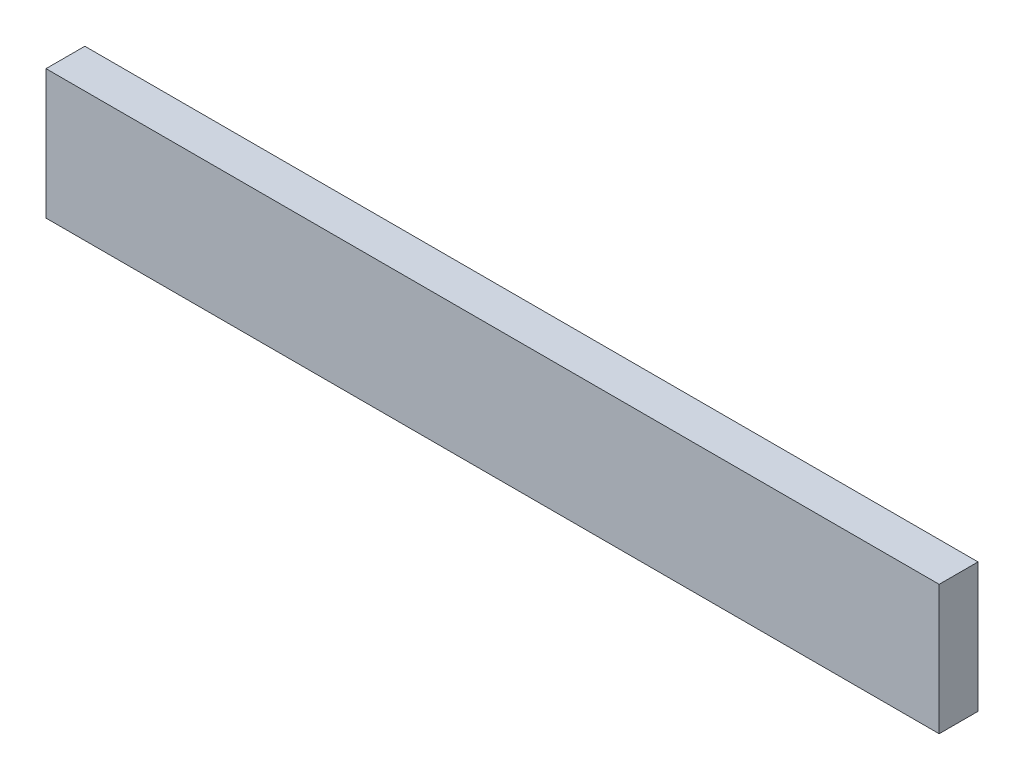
SolidWorks part; units mm, degrees
ref_plane "Plan de face" through (0, 0, 0) normal (0, 0, 1) x (1, 0, 0)
ref_plane "Plan de dessus" through (0, 0, 0) normal (0, 1, 0) x (1, 0, 0)
ref_plane "Plan de droite" through (0, 0, 0) normal (1, 0, 0) x (0, 0, -1)
sketch "Esquisse1" plane through (0, 0, 0) normal (0, 0, 1) x (1, 0, 0)
  line L1 (-207, -30) -> (207, -30)
  line L2 (-207, -30) -> (-207, 30)
  line L3 (-207, 30) -> (207, 30)
  line L4 (207, -30) -> (207, 30)
  line L5 (-207, -30) -> (207, 30) construction
  line L6 (-207, 30) -> (207, -30) construction
  point P0 (0, 0)
  dimension "D1" = 414
  dimension "D2" = 60
extrude "Boss.-Extru.1" add sketch "Esquisse1" along normal blind 18
